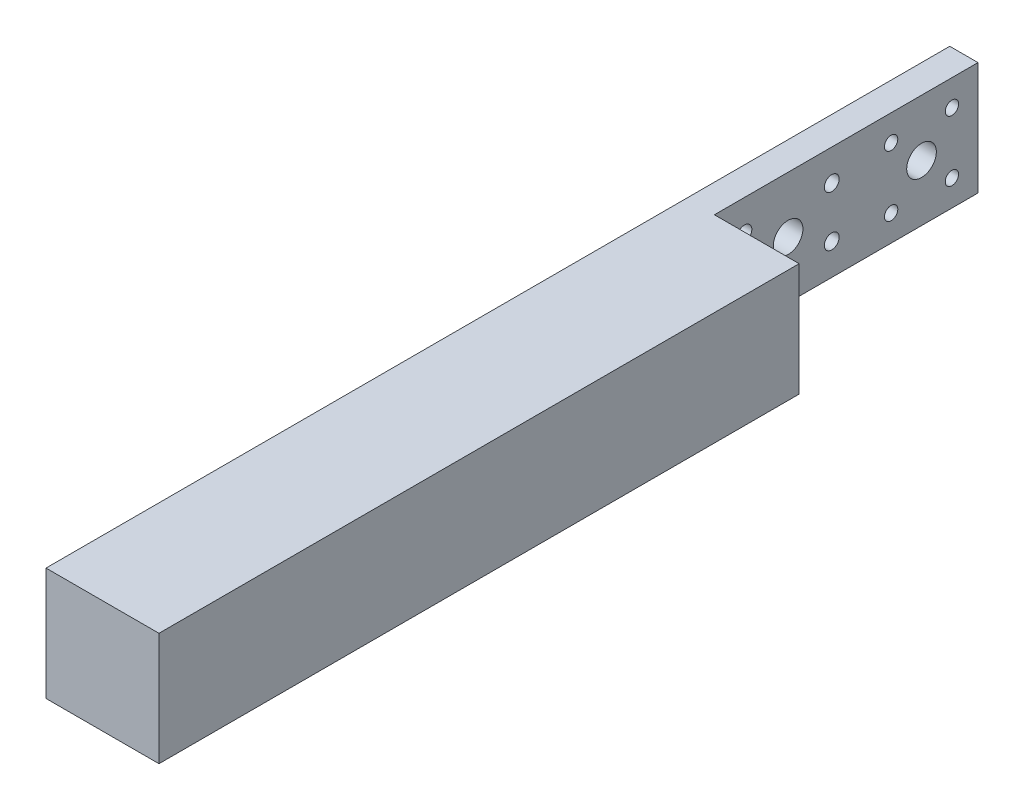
SolidWorks part; units mm, degrees
ref_plane "Front Plane" through (0, 0, 0) normal (0, 0, 1) x (1, 0, 0)
ref_plane "Top Plane" through (0, 0, 0) normal (0, 1, 0) x (1, 0, 0)
ref_plane "Right Plane" through (0, 0, 0) normal (1, 0, 0) x (0, 0, -1)
sketch "Sketch1" plane through (0, 0, 0) normal (0, 0, 1) x (1, 0, 0)
  line L1 (-19.05, 19.05) -> (19.05, 19.05)
  line L2 (-19.05, 19.05) -> (-19.05, -19.05)
  line L3 (-19.05, -19.05) -> (19.05, -19.05)
  line L4 (19.05, 19.05) -> (19.05, -19.05)
  line L5 (-19.05, 19.05) -> (19.05, -19.05) construction
  line L6 (-19.05, -19.05) -> (19.05, 19.05) construction
  point P0 (0, 0)
  dimension "D1" = 38.1
  dimension "D2" = 38.1
extrude "Boss-Extrude1" add sketch "Sketch1" along normal blind 304.8
sketch "Sketch2" plane through (19.05, 0, 0) normal (1, 0, 0) x (0, 0, -1)
  line L0 (-304.8, 0) -> (0, 0) construction
  line L1 (-304.8, -19.05) -> (-304.8, 19.05) construction
  line L2 (0, -19.05) -> (0, 19.05) construction
  circle A0 centre (-19.05, 0) radius 5
  circle A1 centre (-64.05, 0) radius 5
  dimension "D1" = 10
  dimension "D2" = 45
  dimension "D3" = 19.05
extrude "Cut-Extrude1" cut sketch "Sketch2" against normal through all
sketch "Sketch4" plane through (19.05, 0, 0) normal (1, 0, 0) x (0, 0, -1)
  line L1 (-64.05, 17) -> (-78.7724, 8.5) construction
  line L2 (-78.7724, 8.5) -> (-78.7724, -8.5) construction
  line L3 (-78.7724, -8.5) -> (-64.05, -17) construction
  line L4 (-64.05, -17) -> (-49.3276, -8.5) construction
  line L5 (-49.3276, -8.5) -> (-49.3276, 8.5) construction
  line L6 (-49.3276, 8.5) -> (-64.05, 17) construction
  circle A0 centre (-64.05, 0) radius 17 construction
  circle A2 centre (-64.05, 0) radius 14.7224 construction
  circle A3 centre (-78.7724, 8.5) radius 2.5
  dimension "D1" = 34
  dimension "D3" = 5
extrude "Cut-Extrude3" cut sketch "Sketch4" against normal through all
pattern_circular "CirPattern2" count 6 over 360 about axis through (0, 0, 64.05) along (1, 0, 0) of "Cut-Extrude3"
sketch "Sketch5" plane through (19.05, 0, 0) normal (1, 0, 0) x (0, 0, -1)
  line L1 (-29.303, -10.253) -> (-8.797, -10.253) construction
  line L2 (-29.303, -10.253) -> (-29.303, 10.253) construction
  line L3 (-29.303, 10.253) -> (-8.797, 10.253) construction
  line L4 (-8.797, -10.253) -> (-8.797, 10.253) construction
  line L5 (-29.303, -10.253) -> (-8.797, 10.253) construction
  line L6 (-29.303, 10.253) -> (-8.797, -10.253) construction
  circle A0 centre (-29.303, 10.253) radius 2.25
  point P0 (-19.05, 0)
  dimension "D2" = 4.5
  dimension "D1" = 29
extrude "Cut-Extrude4" cut sketch "Sketch5" against normal through all
pattern_circular "CirPattern3" count 4 over 360 about axis through (0, 0, 19.05) along (1, 0, 0) of "Cut-Extrude4"
sketch "Sketch6" plane through (19.05, 0, 0) normal (1, 0, 0) x (0, 0, -1)
  line L0 (-304.8, -19.05) -> (0, -19.05) construction
  line L1 (0, 19.05) -> (-88.9, 19.05)
  line L2 (0, 19.05) -> (0, -19.05)
  line L3 (0, -19.05) -> (-88.9, -19.05)
  line L4 (-88.9, 19.05) -> (-88.9, -19.05)
  dimension "D1" = 88.9
extrude "Cut-Extrude5" cut sketch "Sketch6" against normal blind 28.575
